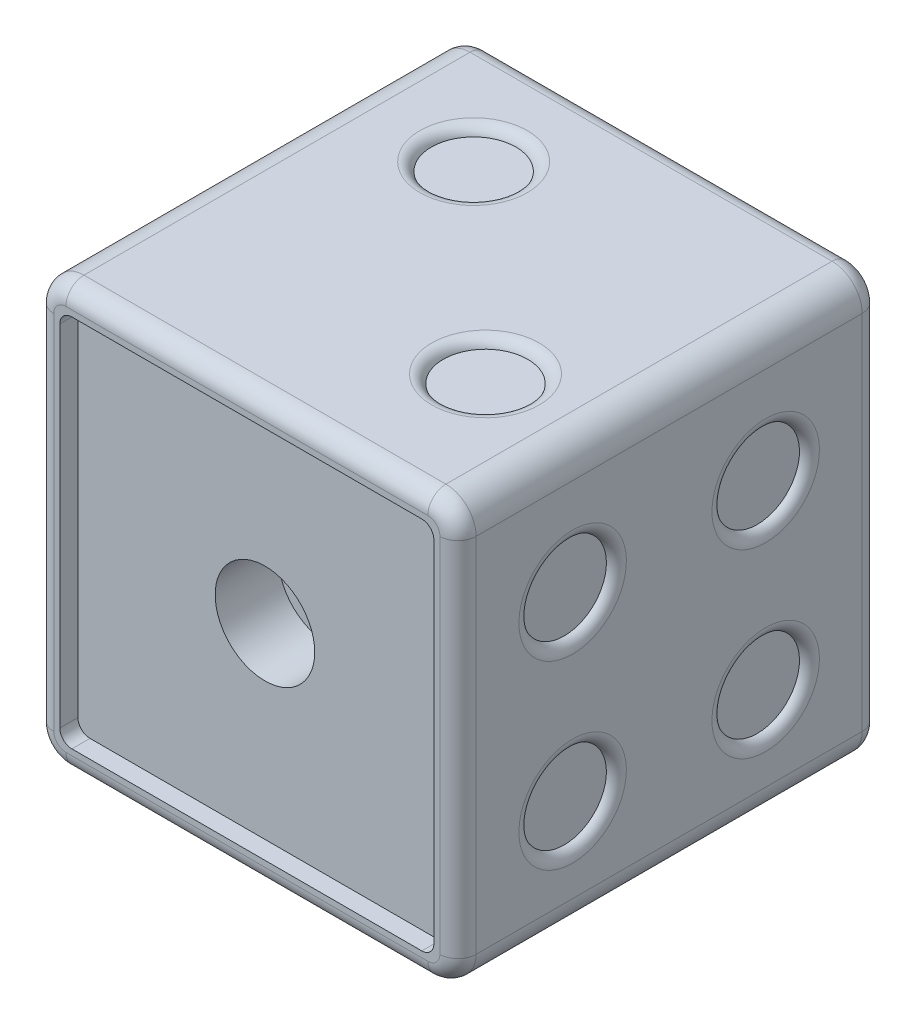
SolidWorks part; units mm, degrees
ref_plane "Front Plane" through (0, 0, 0) normal (0, 0, 1) x (1, 0, 0)
ref_plane "Top Plane" through (0, 0, 0) normal (0, 1, 0) x (1, 0, 0)
ref_plane "Right Plane" through (0, 0, 0) normal (1, 0, 0) x (0, 0, -1)
sketch "Sketch1" plane through (0, 0, 0) normal (0, 0, 1) x (1, 0, 0)
  line L1 (17.5, -17.5) -> (-17.5, -17.5)
  line L2 (17.5, -17.5) -> (17.5, 17.5)
  line L3 (17.5, 17.5) -> (-17.5, 17.5)
  line L4 (-17.5, -17.5) -> (-17.5, 17.5)
  line L5 (17.5, -17.5) -> (-17.5, 17.5) construction
  line L6 (17.5, 17.5) -> (-17.5, -17.5) construction
  point P0 (0, 0)
  dimension "D1" = 35
  dimension "D2" = 35
extrude "Boss-Extrude1" add sketch "Sketch1" along normal blind 35
sketch "Sketch2" plane through (0, 0, 35) normal (0, 0, 1) x (1, 0, 0)
  line L1 (15.5, -15.5) -> (-15.5, -15.5)
  line L2 (15.5, -15.5) -> (15.5, 15.5)
  line L3 (15.5, 15.5) -> (-15.5, 15.5)
  line L4 (-15.5, -15.5) -> (-15.5, 15.5)
  line L5 (15.5, -15.5) -> (-15.5, 15.5) construction
  line L6 (15.5, 15.5) -> (-15.5, -15.5) construction
  point P0 (0, 0)
  dimension "D1" = 31
  dimension "D2" = 31
extrude "Cut-Extrude1" cut sketch "Sketch2" against normal blind 1.5
fillet "Fillet1" radius 1 4 edges at (-15.5, -15.5, 34.25) (15.5, -15.5, 34.25) (15.5, 15.5, 34.25) (-15.5, 15.5, 34.25)
sketch "Sketch11" plane through (0, 0, 33.5) normal (0, 0, 1) x (1, 0, 0)
  circle A0 centre (0, 0) radius 4.125
  dimension "D1" = 8.25
extrude "Cut-Extrude6" cut sketch "Sketch11" against normal blind 5.25
fillet "Fillet3" radius 2.5 4 edges at (-17.5, 17.5, 17.5) (17.5, 17.5, 17.5) (17.5, -17.5, 17.5) (-17.5, -17.5, 17.5)
fillet "Fillet4" radius 1.5 16 edges at (-16.7678, -16.7678, 0) (-17.5, 0, 0) (-16.7678, 16.7678, 0) (0, 17.5, 0) (16.7678, 16.7678, 0) (17.5, 0, 0) (16.7678, -16.7678, 0) (0, -17.5, 0) (-16.7678, -16.7678, 35) (-17.5, 0, 35) (-16.7678, 16.7678, 35) (0, 17.5, 35) (16.7678, 16.7678, 35) (17.5, 0, 35) (16.7678, -16.7678, 35) (0, -17.5, 35)
sketch "Sketch13" plane through (0, -17.5, 0) normal (0, -1, 0) x (1, 0, 0)
  line L0 (-15, 17.5) -> (15, 17.5) construction
  line L1 (-15, 33.5) -> (-15, 1.5) construction
  line L2 (15, 1.5) -> (15, 33.5) construction
  circle A0 centre (0, 17.5) radius 3.5
  dimension "D1" = 7
extrude "1" cut sketch "Sketch13" against normal blind 0.7
sketch "Sketch14" plane through (17.5, 0, 0) normal (1, 0, 0) x (0, 0, -1)
  line L0 (-17.5, 15) -> (-17.5, -15) construction
  line L1 (-1.5, 15) -> (-33.5, 15) construction
  line L2 (-33.5, -15) -> (-1.5, -15) construction
  line L3 (-33.5, 15) -> (-33.5, -15) construction
  circle A0 centre (-25.5, 7) radius 3.5
  circle A1 centre (-25.5, -8) radius 3.5
  circle A2 centre (-9.5, -8) radius 3.5
  circle A3 centre (-9.5, 7) radius 3.5
  dimension "D1" = 7
  dimension "D2" = 7
  dimension "D3" = 8
  dimension "D4" = 8
  dimension "D5" = 8
  dimension "D6" = 7
extrude "4" cut sketch "Sketch14" against normal blind 0.7
sketch "Sketch15" plane through (0, 0, 0) normal (0, 0, -1) x (-1, 0, 0)
  line L0 (-16, 0) -> (16, 0) construction
  line L1 (-16, 15) -> (-16, -15) construction
  line L2 (16, -15) -> (16, 15) construction
  line L3 (0, 16) -> (0, -16) construction
  line L4 (15, 16) -> (-15, 16) construction
  line L5 (-15, -16) -> (15, -16) construction
  circle A0 centre (0, 0) radius 3.5
  circle A1 centre (-8, 9) radius 3.5
  circle A2 centre (-8, -9) radius 3.5
  circle A3 centre (8, -9) radius 3.5
  circle A4 centre (8, 9) radius 3.5
  dimension "D1" = 7
  dimension "D2" = 7
  dimension "D3" = 8
  dimension "D4" = 7
extrude "5" cut sketch "Sketch15" against normal blind 0.7
sketch "Sketch16" plane through (-17.5, 0, 0) normal (-1, 0, 0) x (0, 0, 1)
  line L0 (1.5, -15) -> (33.5, 15) construction
  line L1 (1.5, 15) -> (1.5, -15) construction
  line L2 (33.5, 15) -> (1.5, 15) construction
  circle A0 centre (17.5, 0) radius 3.5
  circle A1 centre (9.5, 8) radius 3.5
  circle A2 centre (24.9678, -8.499) radius 3.5
  dimension "D1" = 7
  dimension "D2" = 7
  dimension "D3" = 8
  dimension "D4" = 7
extrude "3" cut sketch "Sketch16" against normal blind 0.7
sketch "Sketch17" plane through (0, 17.5, 0) normal (0, 1, 0) x (1, 0, 0)
  line L0 (15, -1.5) -> (-15, -1.5) construction
  line L1 (-15, -1.5) -> (-15, -33.5) construction
  line L2 (15, -1.5) -> (-15, -33.5) construction
  circle A0 centre (-7, -9.204) radius 3.5
  circle A1 centre (8.7299, -23.9508) radius 3.5
  dimension "D1" = 7
  dimension "D2" = 7.704
  dimension "D3" = 8
extrude "2" cut sketch "Sketch17" against normal blind 0.7
fillet "Fillet5" radius 1 15 edges at (17.5, -4.5, 25.5) (17.5, -11.5, 9.5) (17.5, 3.5, 9.5) (17.5, 10.5, 25.5) (12.2299, 17.5, 23.9508) (-10.5, 17.5, 9.204) (-17.5, 8, 13) (-17.5, 0, 21) (-17.5, -8.499, 21.4678) (3.5, -17.5, 17.5) (-11.5, -9, 0) (-4.5, 9, 0) (-3.5, 0, 0) (4.5, 9, 0) (11.5, -9, 0)
